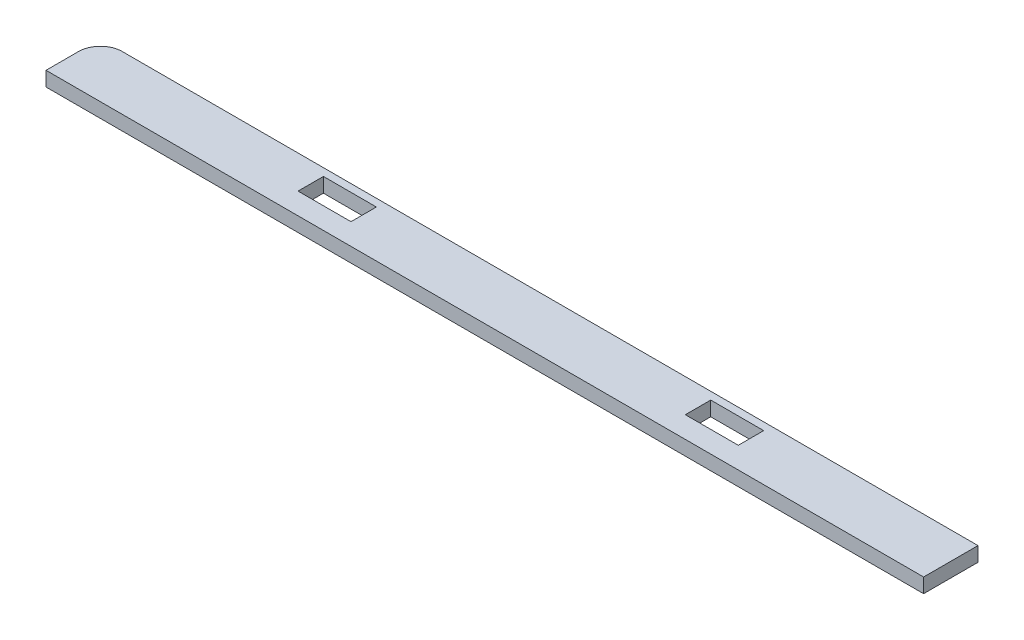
SolidWorks part; units mm, degrees
ref_plane "Front" through (0, 0, 0) normal (0, 0, 1) x (1, 0, 0)
ref_plane "Top" through (0, 0, 0) normal (0, 1, 0) x (1, 0, 0)
ref_plane "Right" through (0, 0, 0) normal (1, 0, 0) x (0, 0, -1)
ref_plane "Plane1" through (0, 3, 0) normal (0, 1, 0) x (1, 0, 0)
sketch "Sketch1" plane through (0, 3, 0) normal (0, 1, 0) x (1, 0, 0)
  line L0 (-121, 106) -> (121, 106)
  line L1 (121, 106) -> (121, 121)
  line L2 (121, 121) -> (-121, 121)
  line L3 (-121, 121) -> (-121, 106)
  dimension "D1" = 242
  dimension "D2" = 121
  dimension "D3" = 106
extrude "Boss-Extrude1" add sketch "Sketch1" against normal blind 4
sketch "Sketch2" plane through (0, 3, 0) normal (0, 1, 0) x (-1, 0, 0)
  line L0 (-57.4019, -116.9) -> (-53.4, -116.9)
  line L1 (-53.4, -113.9) -> (-57.4019, -113.9)
  line L3 (-49.4, -118.9) -> (-64, -118.9)
  line L4 (-49.4, -118.9) -> (-49.4, -111.9)
  line L5 (-49.4, -111.9) -> (-64, -111.9)
  line L6 (-64, -118.9) -> (-64, -111.9)
  arc A0 (-57.4019, -113.9) -> (-57.4019, -116.9) centre (-60, -115.4) cw
  arc A1 (-53.4, -116.9) -> (-53.4, -113.9) centre (-53.4, -115.4) ccw
  dimension "D3" = 4
  dimension "D4" = 4
  dimension "D1" = 2
  dimension "D2" = 2
extrude "Cut-Extrude1" cut sketch "Sketch2" along direction (0, 1, 0) on the side against the normal through all
sketch "Sketch3" plane through (0, 3, 0) normal (0, 1, 0) x (-1, 0, 0)
  line L0 (49.3981, -116.9) -> (53.4, -116.9)
  line L1 (53.4, -113.9) -> (49.3981, -113.9)
  line L3 (57.4, -118.9) -> (42.8, -118.9)
  line L4 (57.4, -118.9) -> (57.4, -111.9)
  line L5 (57.4, -111.9) -> (42.8, -111.9)
  line L6 (42.8, -118.9) -> (42.8, -111.9)
  arc A0 (49.3981, -113.9) -> (49.3981, -116.9) centre (46.8, -115.4) cw
  arc A1 (53.4, -116.9) -> (53.4, -113.9) centre (53.4, -115.4) ccw
  dimension "D3" = 4
  dimension "D4" = 4
  dimension "D1" = 2
  dimension "D2" = 2
extrude "Cut-Extrude2" cut sketch "Sketch3" against normal through all
fillet "Fillet1" radius 6 1 edges at (-121, 1, -121)
